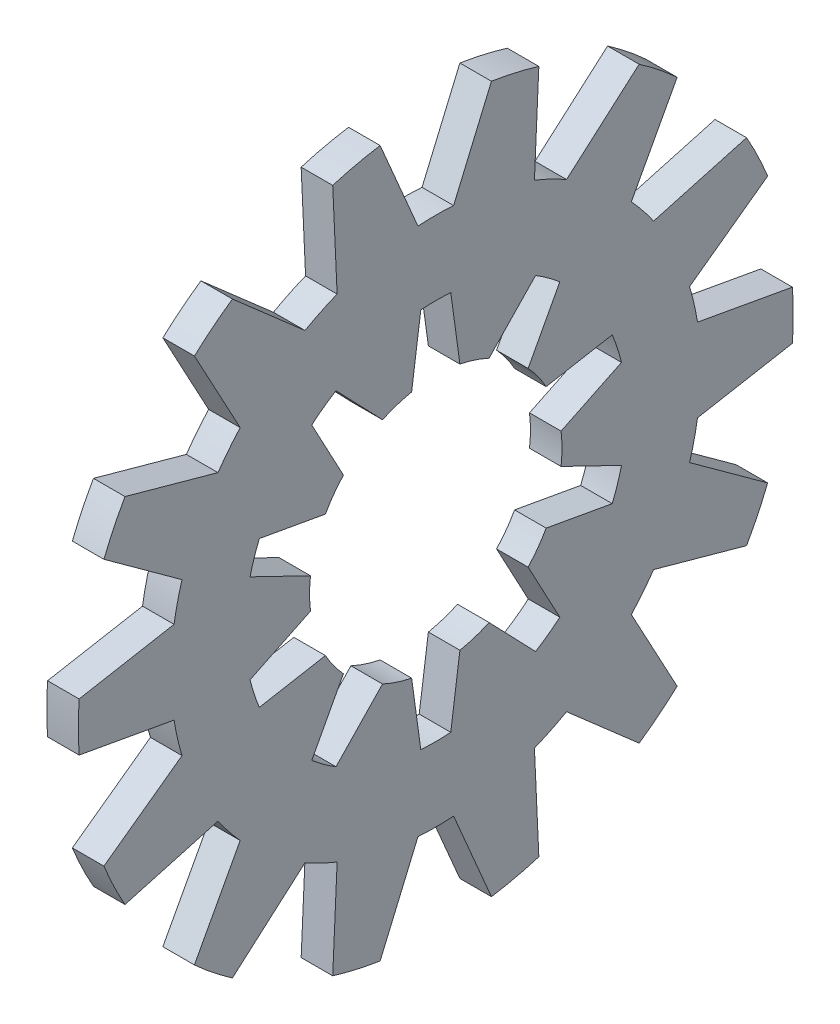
SolidWorks part; units mm, degrees
ref_plane "Plane1" through (0, 0, 0) normal (0, 0, 1) x (1, 0, 0)
ref_plane "Plane2" through (0, 0, 0) normal (0, 1, 0) x (1, 0, 0)
ref_plane "Plane3" through (0, 0, 0) normal (1, 0, 0) x (0, 0, -1)
sketch "SecSke" plane through (0, 0, 0) normal (0, 0, 1) x (1, 0, 0)
  line L0 (-34.925, 0) -> (9.525, 0) construction
  line L1 (0, 3.2512) -> (0, 9.2075)
  line L2 (0, 9.2075) -> (-0.8128, 9.2075)
  line L3 (-0.8128, 9.2075) -> (-0.8128, 3.2512)
  line L4 (-0.8128, 3.2512) -> (0, 3.2512)
  dimension "Thickness" = 0.8128
  dimension "Inside_dia" = 6.5024
  dimension "Outside_dia" = 18.415
revolve "Body" add sketch "SecSke" angle 360 about L0
sketch "ExtCutSke" plane through (0, 0, 0) normal (1, 0, 0) x (0, 0, -1)
  line L0 (0, 0) -> (0, 9.6679) construction
  line L1 (-1.6194, 9.5313) -> (-0.4591, 6.8095)
  line L2 (1.6194, 9.5313) -> (0.4591, 6.8095)
  arc A0 (1.6194, 9.5313) -> (-1.6194, 9.5313) centre (0, 0) ccw
  arc A1 (0.4591, 6.8095) -> (-0.4591, 6.8095) centre (0, 0) ccw
  dimension "Cut_dia" = 13.65
  dimension "Clr_dia" = 19.3357
  dimension "Cut_ang" = 7.714
  dimension "Clr_ang" = 19.286
extrude "ExtCut" cut sketch "ExtCutSke" against normal through all
pattern_circular "ExtCuts" count 14 every 25.714 about axis through (-34.925, 0, 0) along (1, 0, 0) of "ExtCut"
sketch "IntCutSke" plane through (0, 0, 0) normal (1, 0, 0) x (0, 0, -1)
  line L0 (-0.3859, 4.9038) -> (-0.6453, 3.0205)
  line L1 (0.3859, 4.9038) -> (0.6453, 3.0205)
  line L2 (0, 0) -> (0, 4.919) construction
  arc A0 (0.6453, 3.0205) -> (-0.6453, 3.0205) centre (0, 0) ccw
  arc A1 (0.3859, 4.9038) -> (-0.3859, 4.9038) centre (0, 0) ccw
  dimension "cut_dia" = 9.8379
  dimension "Clr_dia" = 6.1773
  dimension "Clr_ang" = 24.12
  dimension "Cut_ang" = 9
extrude "IntCut" cut sketch "IntCutSke" against normal through all
pattern_circular "IntCuts" count 10 every 36 about axis through (-34.925, 0, 0) along (1, 0, 0) of "IntCut"
equation "' \"Inside_dia@SecSke\" = 16"
equation "' \"Outside_dia@SecSke\" = 35"
equation "' \"Thickness@SecSke\" = 1.4"
equation "' \"Count@ExtCuts\" = 16"
equation "' \"Count@IntCuts\" = 12"
equation "' \"Inside_dia@SecSke\" = 10.5"
equation "' \"Outside_dia@SecSke\" = 26"
equation "' \"Thickness@SecSke\" = 1"
equation "' \"Count@ExtCuts\" = 14"
equation "' \"Count@IntCuts\" = 9"
equation "' \"Inside_dia@SecSke\" = 6.4"
equation "' \"Outside_dia@SecSke\" = 17.5"
equation "' \"Thickness@SecSke\" = 0.8"
equation "' \"Count@ExtCuts\" = 12"
equation "' \"Inside_dia@SecSke\" = 4.3"
equation "' \"Outside_dia@SecSke\" = 15"
equation "' \"Thickness@SecSke\" = 0.6"
equation "' \"Count@IntCuts\" = 8"
equation "\"Angle@ExtCuts\" = 360 / \"Count@ExtCuts\""
equation "\"Clr_dia@ExtCutSke\" =  \"Outside_dia@SecSke\" * 1.05"
equation "\"Cut_dia@ExtCutSke\" = \"Outside_dia@SecSke\" - (\"Outside_dia@SecSke\"  - \"Inside_dia@SecSke\" ) * 0.4"
equation "\"Clr_ang@ExtCutSke\" = (360 / \"Count@ExtCuts\") * 0.75"
equation "\"Cut_ang@ExtCutSke\" = (360 / \"Count@ExtCuts\") * 0.3"
equation "\"Angle@IntCuts\" = 360 / \"Count@IntCuts\""
equation "\"Clr_dia@IntCutSke\" =  \"Inside_dia@SecSke\" * 0.95"
equation "\"Cut_dia@IntCutSke\" = \"Inside_dia@SecSke\" + (\"Outside_dia@SecSke\"  - \"Inside_dia@SecSke\" ) * 0.28"
equation "\"Clr_ang@IntCutSke\" = (360 / \"Count@IntCuts\") * 0.67"
equation "\"Cut_ang@IntCutSke\" = (360 / \"Count@IntCuts\") * 0.25"
